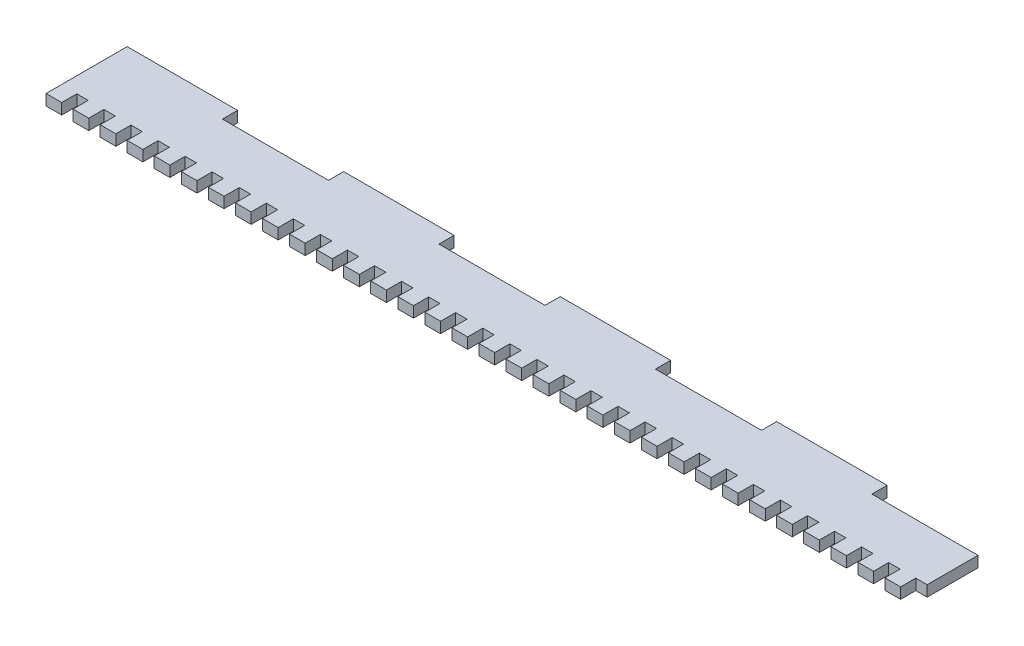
SolidWorks part; units mm, degrees
ref_plane "Front Plane" through (0, 0, 0) normal (0, 0, 1) x (1, 0, 0)
ref_plane "Top Plane" through (0, 0, 0) normal (0, 1, 0) x (1, 0, 0)
ref_plane "Right Plane" through (0, 0, 0) normal (1, 0, 0) x (0, 0, -1)
sketch "Sketch1" plane through (0, 0, 0) normal (0, 1, 0) x (1, 0, 0)
  line L0 (25.908, 19.05) -> (25.908, 15.494)
  line L5 (0, 0) -> (3.683, 0)
  line L6 (0, 0) -> (0, 19.05)
  line L7 (0, 19.05) -> (25.908, 19.05)
  line L8 (203.2, 3.556) -> (203.2, 15.494)
  line L9 (25.908, 15.494) -> (50.8, 15.494)
  line L10 (50.8, 15.494) -> (50.8, 19.05)
  line L11 (50.8, 19.05) -> (76.708, 19.05)
  line L12 (76.708, 19.05) -> (76.708, 15.494)
  line L13 (76.708, 15.494) -> (101.6, 15.494)
  line L14 (101.6, 15.494) -> (101.6, 19.05)
  line L15 (127.508, 19.05) -> (127.508, 15.494)
  line L16 (127.508, 15.494) -> (152.4, 15.494)
  line L17 (152.4, 15.494) -> (152.4, 19.05)
  line L18 (178.308, 19.05) -> (178.308, 15.494)
  line L19 (178.308, 15.494) -> (203.2, 15.494)
  line L20 (3.683, 0) -> (3.683, 3.556)
  line L21 (50.8, 19.05) -> (76.708, 19.05)
  line L22 (101.6, 19.05) -> (127.508, 19.05)
  line L23 (152.4, 19.05) -> (178.308, 19.05)
  line L24 (203.2, 15.494) -> (203.2, 19.05)
  line L25 (3.683, 3.556) -> (6.35, 3.556)
  line L26 (6.35, 3.556) -> (6.35, 0)
  line L27 (10.033, 0) -> (10.033, 3.556)
  line L28 (10.033, 3.556) -> (12.7, 3.556)
  line L29 (12.7, 3.556) -> (12.7, 0)
  line L30 (16.383, 0) -> (16.383, 3.556)
  line L31 (16.383, 3.556) -> (19.05, 3.556)
  line L32 (19.05, 3.556) -> (19.05, 0)
  line L33 (22.733, 0) -> (22.733, 3.556)
  line L34 (22.733, 3.556) -> (25.4, 3.556)
  line L35 (25.4, 3.556) -> (25.4, 0)
  line L36 (29.083, 0) -> (29.083, 3.556)
  line L37 (29.083, 3.556) -> (31.75, 3.556)
  line L38 (31.75, 3.556) -> (31.75, 0)
  line L39 (35.433, 0) -> (35.433, 3.556)
  line L40 (35.433, 3.556) -> (38.1, 3.556)
  line L41 (38.1, 3.556) -> (38.1, 0)
  line L42 (41.783, 0) -> (41.783, 3.556)
  line L43 (41.783, 3.556) -> (44.45, 3.556)
  line L44 (44.45, 3.556) -> (44.45, 0)
  line L45 (48.133, 0) -> (48.133, 3.556)
  line L46 (48.133, 3.556) -> (50.8, 3.556)
  line L47 (50.8, 3.556) -> (50.8, 0)
  line L48 (54.483, 0) -> (54.483, 3.556)
  line L49 (54.483, 3.556) -> (57.15, 3.556)
  line L50 (57.15, 3.556) -> (57.15, 0)
  line L51 (60.833, 0) -> (60.833, 3.556)
  line L52 (60.833, 3.556) -> (63.5, 3.556)
  line L53 (63.5, 3.556) -> (63.5, 0)
  line L54 (67.183, 0) -> (67.183, 3.556)
  line L55 (67.183, 3.556) -> (69.85, 3.556)
  line L56 (69.85, 3.556) -> (69.85, 0)
  line L57 (73.533, 0) -> (73.533, 3.556)
  line L58 (73.533, 3.556) -> (76.2, 3.556)
  line L59 (76.2, 3.556) -> (76.2, 0)
  line L60 (79.883, 0) -> (79.883, 3.556)
  line L61 (79.883, 3.556) -> (82.55, 3.556)
  line L62 (82.55, 3.556) -> (82.55, 0)
  line L63 (86.233, 0) -> (86.233, 3.556)
  line L64 (86.233, 3.556) -> (88.9, 3.556)
  line L65 (88.9, 3.556) -> (88.9, 0)
  line L66 (92.583, 0) -> (92.583, 3.556)
  line L67 (92.583, 3.556) -> (95.25, 3.556)
  line L68 (95.25, 3.556) -> (95.25, 0)
  line L69 (98.933, 0) -> (98.933, 3.556)
  line L70 (98.933, 3.556) -> (101.6, 3.556)
  line L71 (101.6, 3.556) -> (101.6, 0)
  line L72 (105.283, 0) -> (105.283, 3.556)
  line L73 (105.283, 3.556) -> (107.95, 3.556)
  line L74 (107.95, 3.556) -> (107.95, 0)
  line L75 (111.633, 0) -> (111.633, 3.556)
  line L76 (111.633, 3.556) -> (114.3, 3.556)
  line L77 (114.3, 3.556) -> (114.3, 0)
  line L78 (117.983, 0) -> (117.983, 3.556)
  line L79 (117.983, 3.556) -> (120.65, 3.556)
  line L80 (120.65, 3.556) -> (120.65, 0)
  line L81 (124.333, 0) -> (124.333, 3.556)
  line L82 (124.333, 3.556) -> (127, 3.556)
  line L83 (127, 3.556) -> (127, 0)
  line L84 (130.683, 0) -> (130.683, 3.556)
  line L85 (130.683, 3.556) -> (133.35, 3.556)
  line L86 (133.35, 3.556) -> (133.35, 0)
  line L87 (137.033, 0) -> (137.033, 3.556)
  line L88 (137.033, 3.556) -> (139.7, 3.556)
  line L89 (139.7, 3.556) -> (139.7, 0)
  line L90 (143.383, 0) -> (143.383, 3.556)
  line L91 (143.383, 3.556) -> (146.05, 3.556)
  line L92 (146.05, 3.556) -> (146.05, 0)
  line L93 (149.733, 0) -> (149.733, 3.556)
  line L94 (149.733, 3.556) -> (152.4, 3.556)
  line L95 (152.4, 3.556) -> (152.4, 0)
  line L96 (156.083, 0) -> (156.083, 3.556)
  line L97 (156.083, 3.556) -> (158.75, 3.556)
  line L98 (158.75, 3.556) -> (158.75, 0)
  line L99 (162.433, 0) -> (162.433, 3.556)
  line L100 (162.433, 3.556) -> (165.1, 3.556)
  line L101 (165.1, 3.556) -> (165.1, 0)
  line L102 (168.783, 0) -> (168.783, 3.556)
  line L103 (168.783, 3.556) -> (171.45, 3.556)
  line L104 (171.45, 3.556) -> (171.45, 0)
  line L105 (175.133, 0) -> (175.133, 3.556)
  line L106 (175.133, 3.556) -> (177.8, 3.556)
  line L107 (177.8, 3.556) -> (177.8, 0)
  line L108 (181.483, 0) -> (181.483, 3.556)
  line L109 (181.483, 3.556) -> (184.15, 3.556)
  line L110 (184.15, 3.556) -> (184.15, 0)
  line L111 (187.833, 0) -> (187.833, 3.556)
  line L112 (187.833, 3.556) -> (190.5, 3.556)
  line L113 (190.5, 3.556) -> (190.5, 0)
  line L114 (194.183, 0) -> (194.183, 3.556)
  line L115 (194.183, 3.556) -> (196.85, 3.556)
  line L116 (196.85, 3.556) -> (196.85, 0)
  line L117 (200.533, 0) -> (200.533, 3.556)
  line L118 (200.533, 3.556) -> (203.2, 3.556)
  line L120 (6.35, 0) -> (10.033, 0)
  line L121 (12.7, 0) -> (16.383, 0)
  line L122 (19.05, 0) -> (22.733, 0)
  line L123 (25.4, 0) -> (29.083, 0)
  line L124 (31.75, 0) -> (35.433, 0)
  line L125 (38.1, 0) -> (41.783, 0)
  line L126 (44.45, 0) -> (48.133, 0)
  line L127 (50.8, 0) -> (54.483, 0)
  line L128 (57.15, 0) -> (60.833, 0)
  line L129 (63.5, 0) -> (67.183, 0)
  line L130 (69.85, 0) -> (73.533, 0)
  line L131 (76.2, 0) -> (79.883, 0)
  line L132 (82.55, 0) -> (86.233, 0)
  line L133 (88.9, 0) -> (92.583, 0)
  line L134 (95.25, 0) -> (98.933, 0)
  line L135 (101.6, 0) -> (105.283, 0)
  line L136 (107.95, 0) -> (111.633, 0)
  line L137 (114.3, 0) -> (117.983, 0)
  line L138 (120.65, 0) -> (124.333, 0)
  line L139 (127, 0) -> (130.683, 0)
  line L140 (133.35, 0) -> (137.033, 0)
  line L141 (139.7, 0) -> (143.383, 0)
  line L142 (146.05, 0) -> (149.733, 0)
  line L143 (152.4, 0) -> (156.083, 0)
  line L144 (158.75, 0) -> (162.433, 0)
  line L145 (165.1, 0) -> (168.783, 0)
  line L146 (171.45, 0) -> (175.133, 0)
  line L147 (177.8, 0) -> (181.483, 0)
  line L148 (184.15, 0) -> (187.833, 0)
  line L149 (190.5, 0) -> (194.183, 0)
  line L150 (196.85, 0) -> (200.533, 0)
  line L151 (203.2, 3.556) -> (203.2, 0)
  point P13 (50.8, 17.272)
  dimension "D1" = 25.908
  dimension "D2" = 3.556
  dimension "D3" = 25.908
  dimension "D4" = 24.892
  dimension "D5" = 24.892
  dimension "D6" = 203.2
  dimension "D7" = 19.05
  dimension "D9" = 6.35
  dimension "D10" = 3.556
  dimension "D11" = 3.683
  dimension "D8" = 2
  dimension "D12" = 32
extrude "Boss-Extrude1" add sketch "Sketch1" along normal blind 2.54 contours L116 L150 L117 L118 L8 L19 L18 L23 L17 L16 L15 L22 L14 L13 L12 L11 L10 L9 L0 L7 L6 L5 L20 L25 L26 L120 L27 L28 L29 L121 L30 L31 L32 L122 L33 L34 L35 L123 L36 L37 L38 L124 L39 L40 L41 L125 L42 L43 L44 L126 L45
